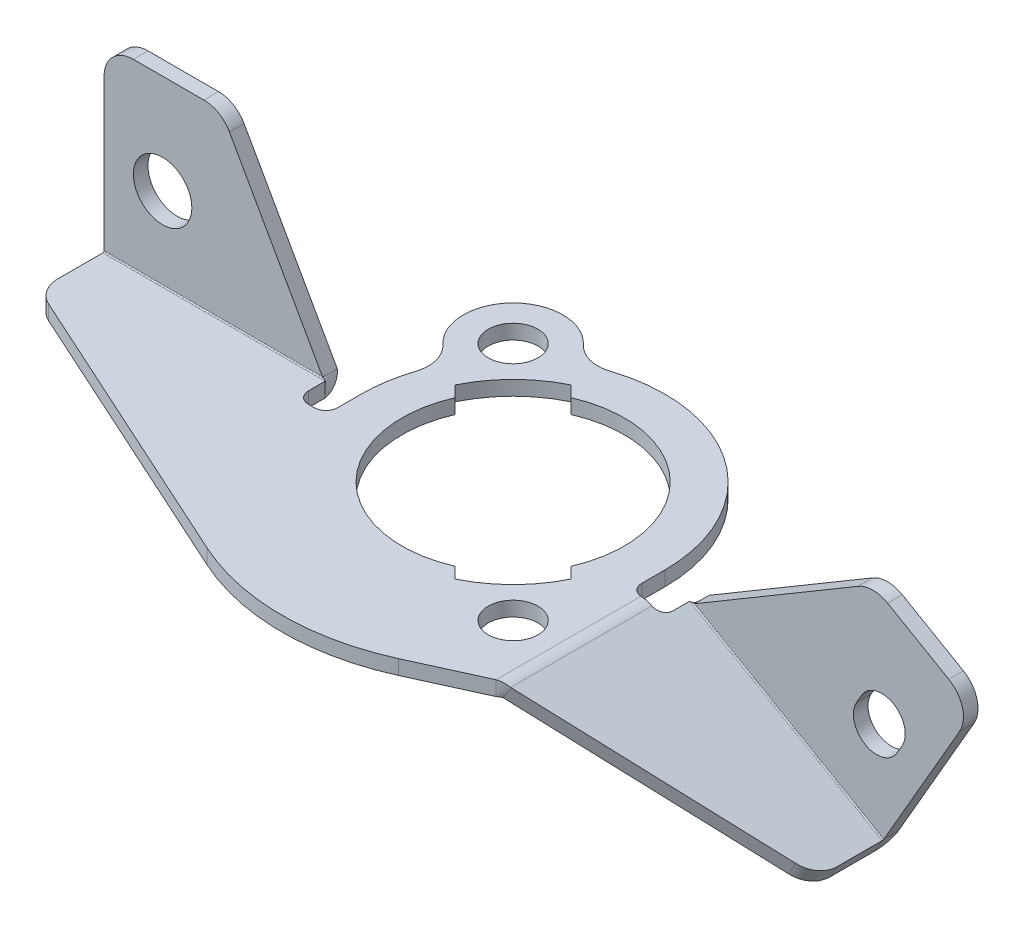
SolidWorks part; units mm, degrees
ref_plane "Plane1" through (0, 0, 0) normal (0, 0, 1) x (1, 0, 0)
ref_plane "Plane2" through (0, 0, 0) normal (0, 1, 0) x (1, 0, 0)
ref_plane "Plane3" through (0, 0, 0) normal (1, 0, 0) x (0, 0, -1)
sketch "Esquisse1" plane through (0, 0, 0) normal (0, 0, 1) x (1, 0, 0)
  line L0 (0, 0) -> (0, 38) construction
  line L1 (0, 0) -> (-32.5346, 32.5346) construction
  line L2 (64.0071, 15.965) -> (64.0076, 14.3054)
  line L3 (56.0076, 16.0316) -> (56.0076, 14.3041)
  line L4 (-9.4247, 19.3242) -> (-7.5402, 17.4397)
  line L5 (9.4247, -19.3242) -> (7.5402, -17.4397)
  line L6 (-19.3242, 9.4247) -> (-17.4397, 7.5402)
  line L7 (19.3242, -9.4247) -> (17.4397, -7.5402)
  line L8 (-26, 0) -> (-26, -4)
  line L10 (-31, 0) -> (-31, -4)
  line L11 (-29, -6) -> (-28, -6)
  line L13 (-69.0076, -8.7975) -> (-69.0076, 27)
  line L14 (-64.0076, 32) -> (-51.9242, 32)
  line L15 (-47.5664, 29.4513) -> (-31, 0)
  line L16 (66.077, -13.3492) -> (16.3482, -35.9581)
  line L17 (-66.077, -13.3492) -> (-16.3482, -35.9581)
  line L18 (47.5664, 29.4513) -> (31, 0)
  line L19 (64.0076, 32) -> (51.9242, 32)
  line L20 (69.0076, -8.7975) -> (69.0076, 27)
  line L22 (29, -6) -> (28, -6)
  line L23 (31, 0) -> (31, -4)
  line L24 (26, 0) -> (26, -4)
  arc A0 (-17.4397, 7.5402) -> (7.5402, -17.4397) centre (0, 0) ccw
  arc A1 (-8.065, 24.7175) -> (-14.3041, 26.3186) centre (-9.9262, 30.4215) cw
  arc A2 (19.3242, -9.4247) -> (9.4247, -19.3242) centre (0, 0) cw
  circle A3 centre (-20.5061, 20.5061) radius 4.25
  arc A4 (-24.7175, 8.065) -> (-26, 0) centre (0, 0) ccw
  arc A5 (-14.3041, 26.3186) -> (-26.3186, 14.3041) centre (-20.5061, 20.5061) ccw
  arc A6 (-24.7175, 8.065) -> (-26.3186, 14.3041) centre (-30.4215, 9.9262) ccw
  arc A7 (-9.4247, 19.3242) -> (-19.3242, 9.4247) centre (0, 0) ccw
  arc A8 (17.4397, -7.5402) -> (-7.5402, 17.4397) centre (0, 0) ccw
  circle A9 centre (20.5061, -20.5061) radius 4.25
  arc A10 (56.0076, 14.3041) -> (64.0076, 14.3054) centre (60.0076, 14.3041) ccw
  arc A11 (26, 0) -> (-8.065, 24.7175) centre (0, 0) ccw
  arc A12 (-26, -4) -> (-28, -6) centre (-28, -4) cw
  arc A13 (-31, -4) -> (-29, -6) centre (-29, -4) ccw
  arc A14 (-64.0076, 32) -> (-69.0076, 27) centre (-64.0076, 27) ccw
  arc A15 (-47.5664, 29.4513) -> (-51.9242, 32) centre (-51.9242, 27) ccw
  circle A16 centre (-59, 15) radius 5
  arc A17 (-69.0076, -8.7975) -> (-66.077, -13.3492) centre (-64.0076, -8.7975) ccw
  arc A18 (69.0076, -8.7975) -> (66.077, -13.3492) centre (64.0076, -8.7975) cw
  arc A19 (64.0071, 15.965) -> (56.0076, 16.0316) centre (60.0076, 16.0316) ccw
  arc A20 (47.5664, 29.4513) -> (51.9242, 32) centre (51.9242, 27) cw
  arc A21 (64.0076, 32) -> (69.0076, 27) centre (64.0076, 27) cw
  arc A22 (31, -4) -> (29, -6) centre (29, -4) cw
  arc A23 (26, -4) -> (28, -6) centre (28, -4) ccw
  arc A24 (-16.3482, -35.9581) -> (16.3482, -35.9581) centre (0, 0) ccw
  point P51 (-69.0076, -12.0168)
  dimension "D3" = 6
  dimension "D4" = 8.5
  dimension "D5" = 17
  dimension "D7" = 2
  dimension "D8" = 5
  dimension "D10" = 5
  dimension "D2" = 45
  dimension "D6" = 7
  dimension "D9" = 15
extrude "Base-Extrusion" add sketch "Esquisse1" along normal mid plane 2.5
sheet metal parameters "Tôlerie 1" parameters "D1"=1.25
bend "Pli défini à plat2" bend angle 90 parameters "D1"=0, "D5"=2
flatten bends "Dépliage 1" parameters "D1"=1.25
sketch "Esquisse-Angle1" plane through (0, 0, 1.25) normal (0, 0, 1) x (1, 0, 0)
process bends "Pliage 1" parameters "D1"=0.2
sketch "Esquisse-Plate1" plane through (0, 0, 1.25) normal (0, 0, 1) x (1, 0, 0)
  line L0 (69.0076, 0) -> (31.3203, 0)
  line L1 (69.0076, -8.7975) -> (69.0076, 27) construction
  line L2 (-31.3203, 0) -> (-69.0076, 0)
  line L3 (-69.0076, -8.7975) -> (-69.0076, 27) construction
  point P10 (50.0038, -7.6015)
bend "Pli défini à plat1" bend angle 90 parameters "D1"=0, "D5"=1
flatten bends "Dépliage 2" parameters "D1"=0
sketch "Esquisse-Angle2" plane through (0, 0, 1.25) normal (0, 0, 1) x (1, 0, 0)
process bends "Pliage 2" parameters "D1"=0
sketch "Esquisse-Plate2" plane through (0, 0, 1.25) normal (0, 0, 1) x (1, 0, 0)
  line L0 (28.5, -6) -> (28.5, -30.4334)
  line L1 (29, -6) -> (28, -6) construction
  point P5 (26.2934, -18.2167)
bend "Pli défini à plat3" bend radius 1.25 bend angle 30 parameters "D5"=1
